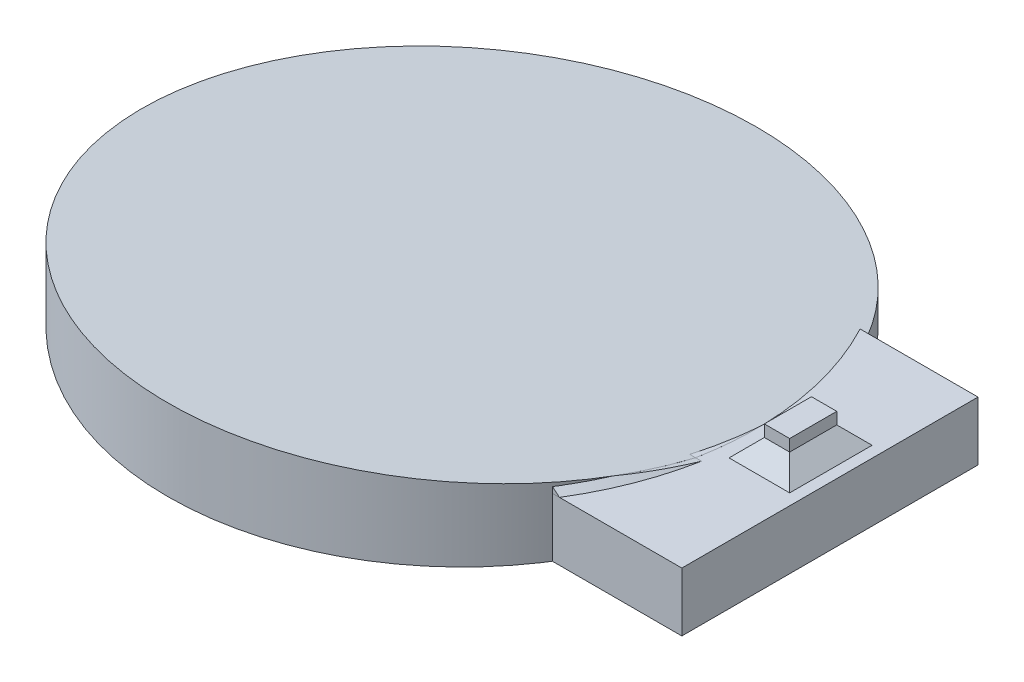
SolidWorks part; units mm, degrees
other "Detailelement1"
other "Detailelement4"
other "Detailelement6"
other "Detailelement7"
ref_plane "XZ (Vo, Hi)" through (0, 0, 0) normal (0, 0, 1) x (1, 0, 0)
ref_plane "XY (Ob, Un)" through (0, 0, 0) normal (0, 1, 0) x (1, 0, 0)
ref_plane "YZ (Li, Re)" through (0, 0, 0) normal (1, 0, 0) x (0, 0, -1)
sketch "Skizze1" plane through (0, 0, 0) normal (0, 1, 0) x (1, 0, 0)
  circle A0 centre (0, 0) radius 50
  dimension "D1" = 100
extrude "Linear austragen1" add sketch "Skizze1" along normal blind 15
sketch "Skizze4" plane through (0, 0, 0) normal (1, 0, 0) x (0, 0, -1)
  line L0 (-50, 13.8018) -> (50, 4.432)
  line L1 (50, 0) -> (50, 15) construction
extrude "Schnitt-Linear austragen1" cut sketch "Skizze4" against normal through all and the other way through all
sketch "Skizze2" plane through (0, 0, 0) normal (0, 1, 0) x (1, 0, 0)
  line L0 (64.1693, 23.5001) -> (44.1332, 23.5001)
  line L1 (64.1693, 23.5001) -> (64.1693, -26.8267)
  line L2 (64.1693, -26.8267) -> (42.194, -26.8267)
  circle A0 centre (0, 0) radius 50 construction
  arc A1 (42.194, -26.8267) -> (44.1332, 23.5001) centre (0, 0) ccw
extrude "Linear austragen2" add sketch "Skizze2" along normal blind 10 separate body
sketch "Skizze3" plane through (0, 10, 0) normal (0, 1, 0) x (-1, 0, 0)
  line L1 (-54.9713, 3.6036) -> (-59.2701, 3.6036)
  line L2 (-54.9713, 3.6036) -> (-54.9713, -4.4021)
  line L3 (-54.9713, -4.4021) -> (-59.2701, -4.4021)
  line L4 (-59.2701, 3.6036) -> (-59.2701, -4.4021)
extrude "Linear austragen3" add sketch "Skizze3" along normal blind 5 separate body
other "Kehlnaht1" parameters "D10"=6, "D11"=3, "D12"=0, "D13"=3, "D14"=0
other "Kehlnaht4" parameters "D10"=6, "D11"=3, "D12"=0, "D13"=3, "D14"=0
other "Kehlnaht6" parameters "D10"=6, "D11"=1, "D12"=0, "D13"=3, "D14"=0
other "Kehlnaht7" parameters "D10"=6, "D11"=1, "D12"=0, "D13"=3, "D14"=0
